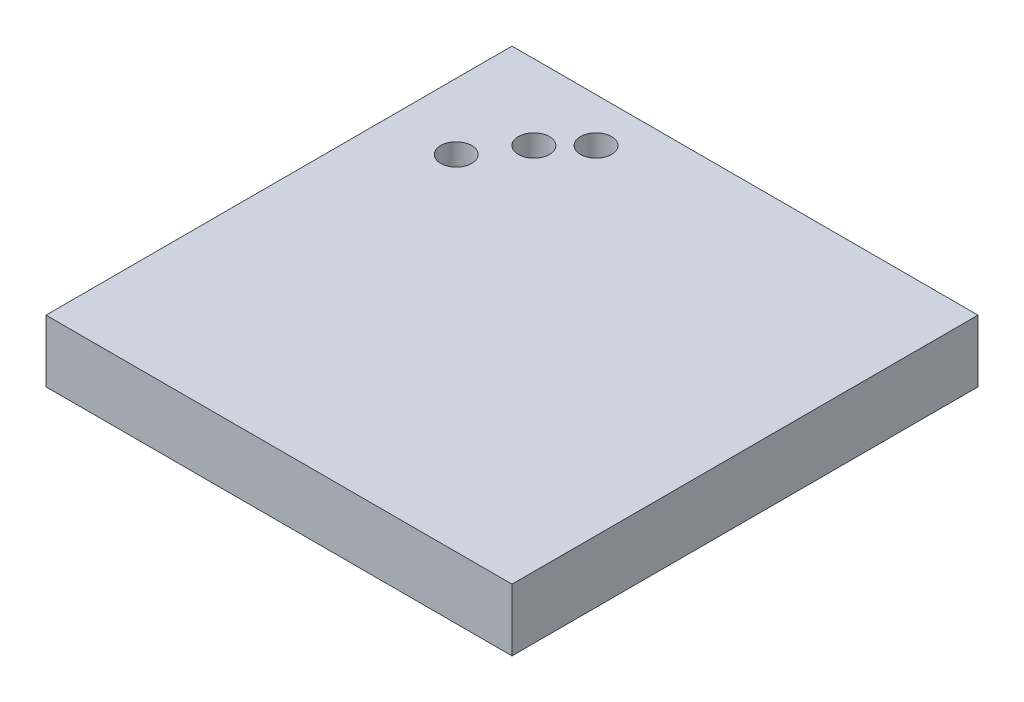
SolidWorks part; units mm, degrees
ref_plane "Front" through (0, 0, 0) normal (0, 0, 1) x (1, 0, 0)
ref_plane "Top" through (0, 0, 0) normal (0, 1, 0) x (1, 0, 0)
ref_plane "Right" through (0, 0, 0) normal (1, 0, 0) x (0, 0, -1)
sketch "Sketch1" plane through (0, 0, 0) normal (0, 1, 0) x (1, 0, 0)
  line L0 (75, -75) -> (-75, 75) construction
  line L1 (-75, 75) -> (75, 75)
  line L2 (-75, 75) -> (-75, -75)
  line L3 (-75, -75) -> (75, -75)
  line L4 (75, 75) -> (75, -75)
  dimension "D1" = 150
  dimension "D2" = 150
extrude "Extrude1" add sketch "Sketch1" along normal blind 20
sketch "Sketch2" plane through (0, 20, 0) normal (0, 1, 0) x (-1, 0, 0)
  line L0 (75, -75) -> (75, 75) construction
  line L1 (-75, -75) -> (75, -75) construction
  circle A0 centre (33.76, -60.81) radius 5
  dimension "D3" = 10
  dimension "D1" = 41.24
  dimension "D2" = 14.19
extrude "Cut-Extrude1" cut sketch "Sketch2" against normal blind 10
sketch "Sketch3" plane through (0, 20, 0) normal (0, 1, 0) x (-1, 0, 0)
  circle A1 centre (33.76, -60.81) radius 5 construction
  point P0 (33.76, -60.81)
other "TPattern1" parameters "D0"=10, "D1"=10, "D2"=20, "D3"=25, "D4"=30, "D5"=55
